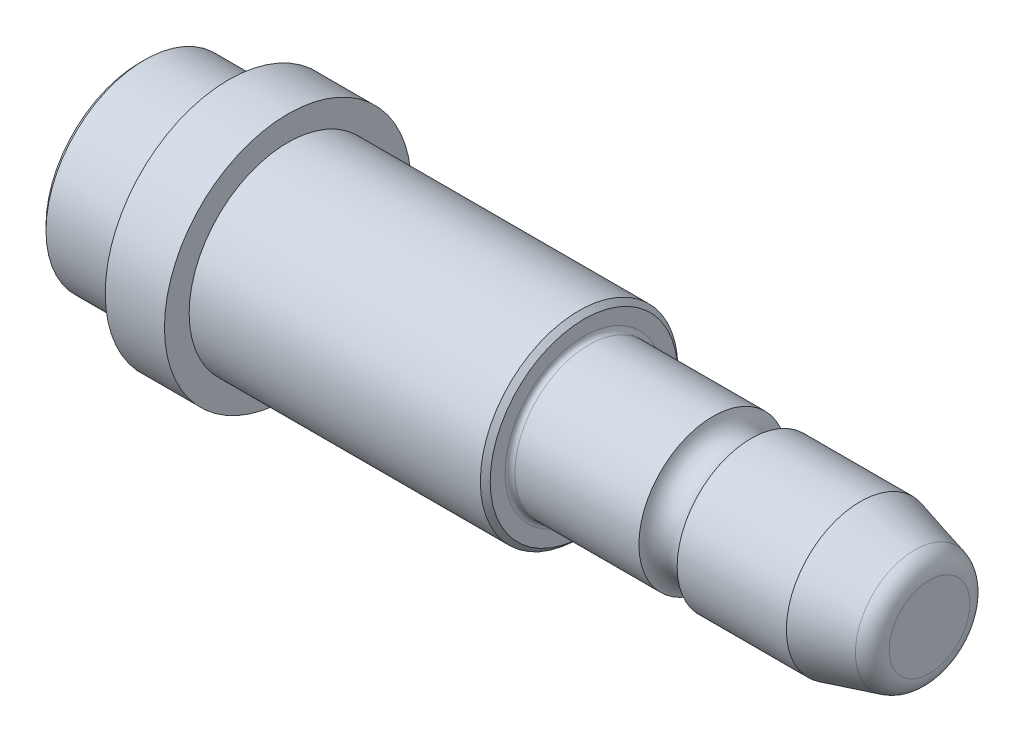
SolidWorks part; units mm, degrees
ref_plane "Face" through (0, 0, 0) normal (0, 0, 1) x (1, 0, 0)
ref_plane "Dessus" through (0, 0, 0) normal (0, 1, 0) x (1, 0, 0)
ref_plane "Droite" through (0, 0, 0) normal (1, 0, 0) x (0, 0, -1)
sketch "Esquisse1" plane through (0, 0, 0) normal (0, 0, 1) x (1, 0, 0)
  line L0 (9, 12.5) -> (15, 12.5)
  line L1 (15, 12.5) -> (15, 10)
  line L2 (15, 10) -> (45, 10)
  line L5 (45, 10) -> (45, 7.5)
  line L6 (45, 7.5) -> (58.0635, 7.5)
  line L7 (73, 7.5) -> (80, 5.6244)
  line L8 (80, 5.6244) -> (80, 0)
  line L9 (9, 12.5) -> (9, 10)
  line L10 (-12.9926, 0) -> (109.8887, 0) construction
  line L11 (9, 10) -> (0, 10)
  line L12 (61.9365, 7.5) -> (73, 7.5)
  line L13 (0, 10) -> (0, 0)
  line L14 (80, 0) -> (0, 0)
  arc A0 (58.0635, 7.5) -> (61.9365, 7.5) centre (60, 8) ccw
  dimension "D2" = 2
  dimension "D3" = 20
  dimension "D4" = 9
  dimension "D5" = 6
  dimension "D6" = 8
  dimension "D7" = 36
  dimension "D8" = 35
  dimension "D9" = 15
  dimension "D10" = 7
  dimension "D11" = 15
  dimension "D13" = 25
  dimension "D14" = 15
revolve "Base-Révolution" add sketch "Esquisse1" angle 360 about L10
chamfer "Chanfrein1" distance 0.5 angle 45 2 edges at (0, 0, 10) (45, 0, 10)
fillet "Congé1" radius 0.5 1 edges at (45, 0, 7.5)
fillet "Congé2" radius 2 1 edges at (80, 0, 5.6244)
